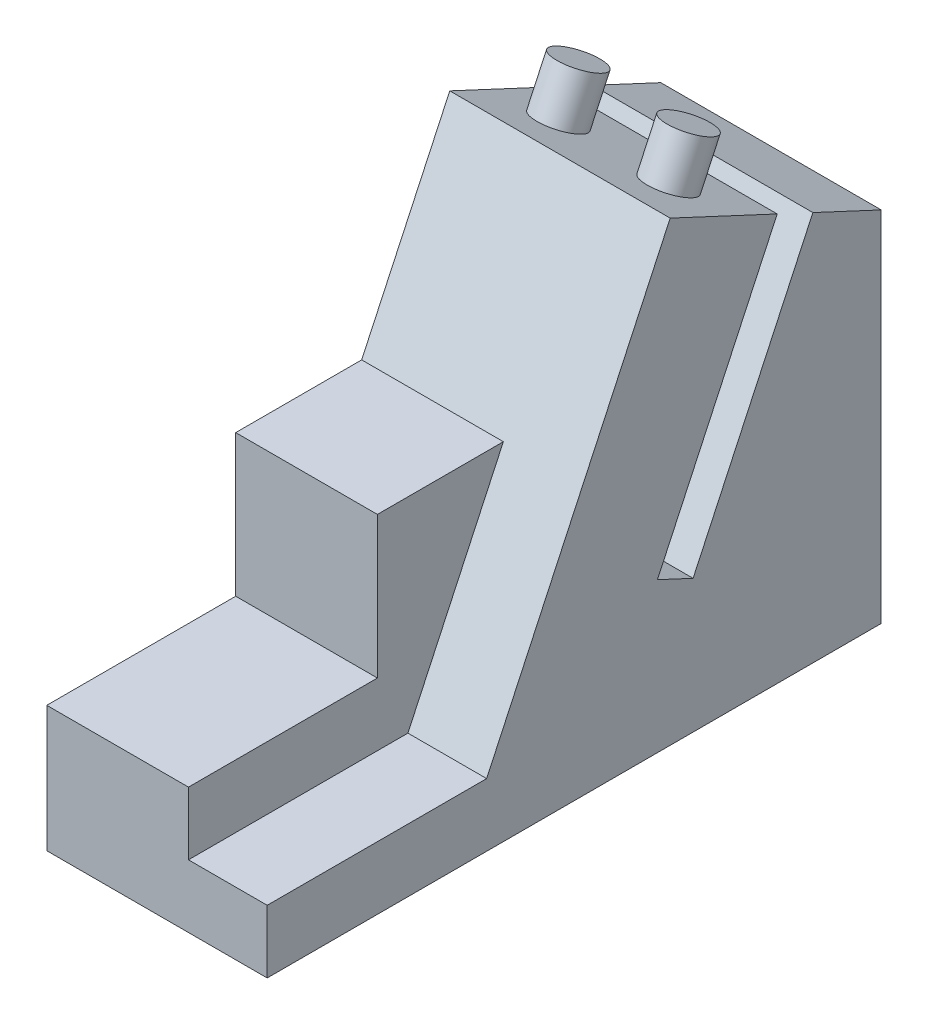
SolidWorks part; units mm, degrees
ref_plane "Front Plane" through (0, 0, 0) normal (0, 0, 1) x (1, 0, 0)
ref_plane "Top Plane" through (0, 0, 0) normal (0, 1, 0) x (1, 0, 0)
ref_plane "Right Plane" through (0, 0, 0) normal (1, 0, 0) x (0, 0, -1)
sketch "Sketch1" plane through (0, 0, 0) normal (1, 0, 0) x (0, 0, -1)
  line L0 (0, 0) -> (78, 0)
  line L1 (78, 0) -> (78, 45.4989)
  line L2 (78, 45.4989) -> (69.3175, 49.5476)
  line L3 (69.3175, 49.5476) -> (54.1033, 16.9206)
  line L4 (54.1033, 16.9206) -> (49.5717, 19.0336)
  line L5 (49.5717, 19.0336) -> (64.786, 51.6607)
  line L6 (64.786, 51.6607) -> (51.1914, 58)
  line L7 (51.1914, 58) -> (40, 34)
  line L8 (40, 34) -> (24, 34)
  line L9 (24, 34) -> (24, 16)
  line L10 (24, 16) -> (0, 16)
  line L11 (0, 16) -> (0, 0)
  dimension "D1" = 16
  dimension "D2" = 18
  dimension "D3" = 58
  dimension "D4" = 65
  dimension "D5" = 36
  dimension "D6" = 5
  dimension "D7" = 16
  dimension "D8" = 24
  dimension "D9" = 78
  dimension "D11" = 15
extrude "Boss-Extrude1" add sketch "Sketch1" along normal blind 28
sketch "Sketch2" plane through (28, 0, 0) normal (1, 0, 0) x (0, 0, -1)
  line L0 (40, 34) -> (27.876, 8)
  line L1 (27.876, 8) -> (0, 8)
  line L2 (0, 16) -> (0, 0) construction
  line L3 (0, 8) -> (-13.8198, 42.3319)
  line L4 (-13.8198, 42.3319) -> (43.2845, 41.0436)
  line L5 (51.1914, 58) -> (40, 34) construction
  line L6 (43.2845, 41.0436) -> (40, 34)
  line L7 (0, 0) -> (78, 0) construction
  dimension "D1" = 65
  dimension "D2" = 8
extrude "Cut-Extrude1" cut sketch "Sketch2" against normal blind 10
sketch "Sketch3" plane through (0, 67.2483, -31.3584) normal (0, 0.9063, -0.4226) x (1, 0, 0)
  line L0 (0, 29.3833) -> (28, 29.3833) construction
  line L1 (0, 36.8833) -> (0, 21.8833) construction
  line L2 (28, 36.8833) -> (28, 21.8833) construction
  line L3 (14, 36.8833) -> (14, 21.8833) construction
  line L4 (28, 36.8833) -> (0, 36.8833) construction
  line L5 (28, 21.8833) -> (0, 21.8833) construction
  circle A0 centre (7, 29.3833) radius 3
  circle A1 centre (21, 29.3833) radius 3
  point P14 (0, 0)
  dimension "D1" = 7
extrude "Boss-Extrude2" add sketch "Sketch3" along normal blind 6
